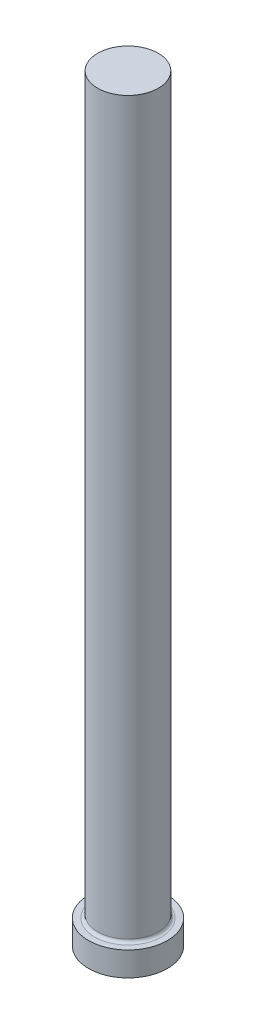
SolidWorks part; units mm, degrees
ref_plane "Plano frontal" through (0, 0, 0) normal (0, 0, 1) x (1, 0, 0)
ref_plane "Plano superior" through (0, 0, 0) normal (0, 1, 0) x (1, 0, 0)
ref_plane "Plano direito" through (0, 0, 0) normal (1, 0, 0) x (0, 0, -1)
sketch "Esboço1" plane through (0, 0, 0) normal (0, 0, 1) x (1, 0, 0)
  line L0 (0, 0) -> (13, 0)
  line L1 (13, 0) -> (13, 8)
  line L2 (13, 8) -> (11, 8)
  line L3 (10, 9) -> (10, 250)
  line L4 (10, 250) -> (0, 250)
  line L5 (0, 250) -> (0, 0) construction
  line L6 (0, 0) -> (0, 250)
  arc A0 (11, 8) -> (10, 9) centre (11, 9) cw
  dimension "D3" = 1
  dimension "D1" = 26
  dimension "D2" = 20
  dimension "D4" = 8
  dimension "D5" = 250
revolve "Revolução1" add sketch "Esboço1" angle 360 about L5
sketch "Esboço2"
  dimension "D1" = 0.975
  dimension "D2" = 2.275
  dimension "D3" = 1.4625
  dimension "D4" = 6.9875
wrap "Envolver1" sketch "Esboço2" source sketch "Esboço2" thickness 0.1 parameters "D1"=0.1
